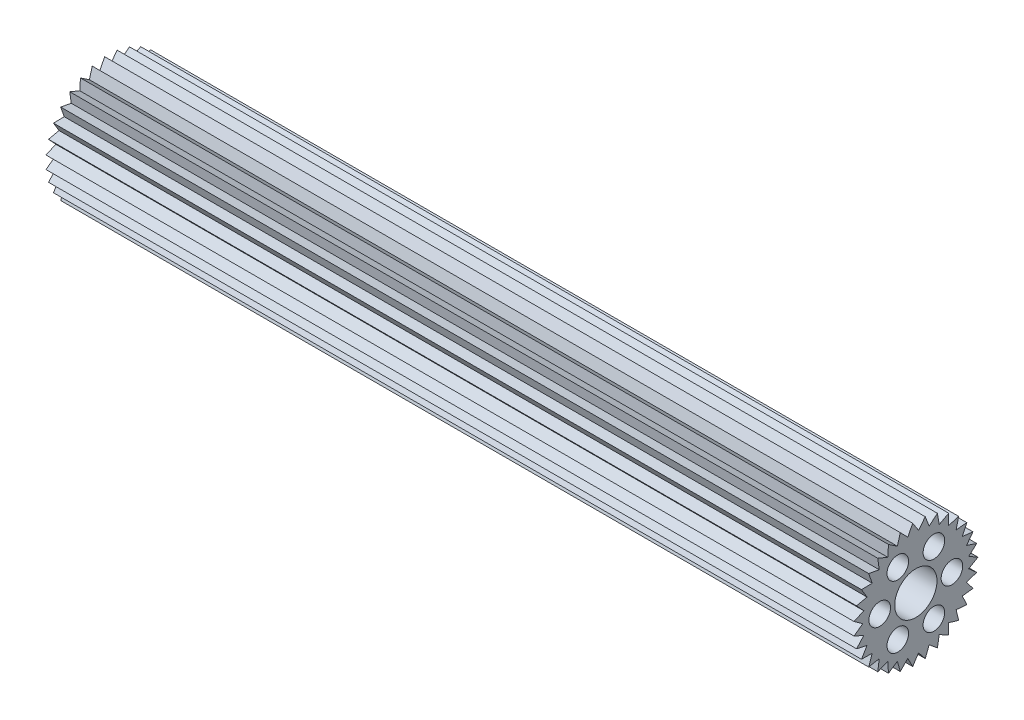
SolidWorks part; units mm, degrees
ref_plane "Front Plane" through (0, 0, 0) normal (0, 0, 1) x (1, 0, 0)
ref_plane "Top Plane" through (0, 0, 0) normal (0, 1, 0) x (1, 0, 0)
ref_plane "Right Plane" through (0, 0, 0) normal (1, 0, 0) x (0, 0, -1)
sketch "Sketch1" plane through (0, 0, 0) normal (1, 0, 0) x (0, 0, -1)
  circle A0 centre (0, 0) radius 15
extrude "Boss-Extrude1" add sketch "Sketch1" along normal blind 200
sketch "Sketch2" plane through (200, 0, 0) normal (1, 0, 0) x (0, 0, -1)
  circle A0 centre (0, 0) radius 5
extrude "Cut-Extrude1" cut sketch "Sketch2" against normal blind 250
sketch "Sketch3" plane through (0, 0, 0) normal (-1, 0, 0) x (0, 0, 1)
  circle A0 centre (0, 0) radius 15
sketch3d "3DSketch5"
  line L0 (200, 0, -15) -> (198, 0, -15)
  line L1 (198, 0, -15) -> (196.8797, 0, -14.0073)
  line L2 (196.8797, 0, -14.0073) -> (196, 0, -15)
  line L3 (196, 0, -15) -> (198, 0, -15)
  circle A0 centre (200, 0, 0) radius 15 construction
  point P4 (215, 0, 0)
  dimension "D1" = 180
  dimension "D2" = 2
  dimension "D3" = 2
sketch "Sketch5" plane through (200, 0, 0) normal (1, 0, 0) x (0, 0, -1)
  circle A0 centre (0, 0) radius 15
sketch "Sketch6" plane through (0, 0, 0) normal (-1, 0, 0) x (0, 0, 1)
  line L0 (-14.6929, 3.0195) -> (-12.7505, 1.2941)
  line L1 (-15, 0) -> (-12.75, -1.299)
  line L2 (-12.75, -1.299) -> (-12.75, 1.299)
  line L3 (-12.75, 1.299) -> (-15, 0)
  line L4 (-12.7505, 1.2941) -> (-12.2275, 3.839)
  line L5 (-12.2275, 3.839) -> (-14.6929, 3.0195)
  line L6 (-13.7844, 5.9153) -> (-12.229, 3.8343)
  line L7 (-12.229, 3.8343) -> (-11.2044, 6.2218)
  line L8 (-11.2044, 6.2218) -> (-13.7844, 5.9153)
  line L9 (-12.3115, 8.569) -> (-11.2068, 6.2175)
  line L10 (-11.2068, 6.2175) -> (-9.7226, 8.3499)
  line L11 (-9.7226, 8.3499) -> (-12.3115, 8.569)
  line L12 (-10.3345, 10.8719) -> (-9.7259, 8.3461)
  line L13 (-9.7259, 8.3461) -> (-7.8428, 10.1361)
  line L14 (-7.8428, 10.1361) -> (-10.3345, 10.8719)
  line L15 (-7.9345, 12.7297) -> (-7.8467, 10.1331)
  line L16 (-7.8467, 10.1331) -> (-5.6419, 11.5074)
  line L17 (-5.6419, 11.5074) -> (-7.9345, 12.7297)
  line L18 (-5.2096, 14.0663) -> (-5.6463, 11.5052)
  line L19 (-5.6463, 11.5052) -> (-3.21, 12.4075)
  line L20 (-3.21, 12.4075) -> (-5.2096, 14.0663)
  line L21 (-2.2714, 14.827) -> (-3.2148, 12.4063)
  line L22 (-3.2148, 12.4063) -> (-0.6466, 12.7997)
  line L23 (-0.6466, 12.7997) -> (-2.2714, 14.827)
  line L24 (0.7597, 14.9807) -> (-0.6516, 12.7994)
  line L25 (-0.6516, 12.7994) -> (1.9431, 12.6678)
  line L26 (1.9431, 12.6678) -> (0.7597, 14.9807)
  line L27 (3.7598, 14.5212) -> (1.9383, 12.6686)
  line L28 (1.9383, 12.6686) -> (4.4534, 12.0174)
  line L29 (4.4534, 12.0174) -> (3.7598, 14.5212)
  line L30 (6.6059, 13.4671) -> (4.4487, 12.0191)
  line L31 (4.4487, 12.0191) -> (6.7813, 10.8749)
  line L32 (6.7813, 10.8749) -> (6.6059, 13.4671)
  line L33 (9.1816, 11.8616) -> (6.7771, 10.8775)
  line L34 (6.7771, 10.8775) -> (8.8316, 9.2872)
  line L35 (8.8316, 9.2872) -> (9.1816, 11.8616)
  line L36 (11.3814, 9.7706) -> (8.828, 9.2907)
  line L37 (8.828, 9.2907) -> (10.5203, 7.3193)
  line L38 (10.5203, 7.3193) -> (11.3814, 9.7706)
  line L39 (13.1152, 7.2795) -> (10.5175, 7.3234)
  line L40 (10.5175, 7.3234) -> (11.7783, 5.0518)
  line L41 (11.7783, 5.0518) -> (13.1152, 7.2795)
  line L42 (14.3121, 4.4904) -> (11.7764, 5.0563)
  line L43 (11.7764, 5.0563) -> (12.5542, 2.5774)
  line L44 (12.5542, 2.5774) -> (14.3121, 4.4904)
  line L45 (14.923, 1.5175) -> (12.5532, 2.5823)
  line L46 (12.5532, 2.5823) -> (12.816, -0.0025)
  line L47 (12.816, -0.0025) -> (14.923, 1.5175)
  line L48 (14.923, -1.5175) -> (12.816, 0.0025)
  line L49 (12.816, 0.0025) -> (12.5532, -2.5823)
  line L50 (12.5532, -2.5823) -> (14.923, -1.5175)
  line L51 (14.3121, -4.4904) -> (12.5542, -2.5774)
  line L52 (12.5542, -2.5774) -> (11.7764, -5.0563)
  line L53 (11.7764, -5.0563) -> (14.3121, -4.4904)
  line L54 (13.1152, -7.2795) -> (11.7783, -5.0518)
  line L55 (11.7783, -5.0518) -> (10.5175, -7.3234)
  line L56 (10.5175, -7.3234) -> (13.1152, -7.2795)
  line L57 (11.3814, -9.7706) -> (10.5203, -7.3193)
  line L58 (10.5203, -7.3193) -> (8.828, -9.2907)
  line L59 (8.828, -9.2907) -> (11.3814, -9.7706)
  line L60 (9.1816, -11.8616) -> (8.8316, -9.2872)
  line L61 (8.8316, -9.2872) -> (6.7771, -10.8775)
  line L62 (6.7771, -10.8775) -> (9.1816, -11.8616)
  line L63 (6.6059, -13.4671) -> (6.7813, -10.8749)
  line L64 (6.7813, -10.8749) -> (4.4487, -12.0191)
  line L65 (4.4487, -12.0191) -> (6.6059, -13.4671)
  line L66 (3.7598, -14.5212) -> (4.4534, -12.0174)
  line L67 (4.4534, -12.0174) -> (1.9383, -12.6686)
  line L68 (1.9383, -12.6686) -> (3.7598, -14.5212)
  line L69 (0.7597, -14.9807) -> (1.9431, -12.6678)
  line L70 (1.9431, -12.6678) -> (-0.6516, -12.7994)
  line L71 (-0.6516, -12.7994) -> (0.7597, -14.9807)
  line L72 (-2.2714, -14.827) -> (-0.6466, -12.7997)
  line L73 (-0.6466, -12.7997) -> (-3.2148, -12.4063)
  line L74 (-3.2148, -12.4063) -> (-2.2714, -14.827)
  line L75 (-5.2096, -14.0663) -> (-3.21, -12.4075)
  line L76 (-3.21, -12.4075) -> (-5.6463, -11.5052)
  line L77 (-5.6463, -11.5052) -> (-5.2096, -14.0663)
  line L78 (-7.9345, -12.7297) -> (-5.6419, -11.5074)
  line L79 (-5.6419, -11.5074) -> (-7.8467, -10.1331)
  line L80 (-7.8467, -10.1331) -> (-7.9345, -12.7297)
  line L81 (-10.3345, -10.8719) -> (-7.8428, -10.1361)
  line L82 (-7.8428, -10.1361) -> (-9.7259, -8.3461)
  line L83 (-9.7259, -8.3461) -> (-10.3345, -10.8719)
  line L84 (-12.3115, -8.569) -> (-9.7226, -8.3499)
  line L85 (-9.7226, -8.3499) -> (-11.2068, -6.2175)
  line L86 (-11.2068, -6.2175) -> (-12.3115, -8.569)
  line L87 (-13.7844, -5.9153) -> (-11.2044, -6.2218)
  line L88 (-11.2044, -6.2218) -> (-12.229, -3.8343)
  line L89 (-12.229, -3.8343) -> (-13.7844, -5.9153)
  line L90 (-14.6929, -3.0195) -> (-12.2275, -3.839)
  line L91 (-12.2275, -3.839) -> (-12.7505, -1.2941)
  line L92 (-12.7505, -1.2941) -> (-14.6929, -3.0195)
  circle A0 centre (0, 0) radius 15
  circle A1 centre (-13.5, 0) radius 0.75 construction
  point P101 (0, 0)
  dimension "D1" = 31
extrude "Cut-Extrude2" cut sketch "Sketch6" against normal blind 234 contours L69 L68 M2 | L72 L71 M2 | L75 L74 M2 | L78 L77 M2 | L81 L80 M2 | L84 L83 M2 | L87 L86 M2 | L90 L89 M2 | L92 L1 M2 | L3 L0 M2 | L6 L5 M2 | L9 L8 M2 | L12 L11 M2 | L15 L14 M2 | L18 L17 M2 | L21 L20 M2 | L24 L23 M2 | L27 L26 M2 | L30 L29 M2 | L33 L32 M2 | L36 L35 M2 | L39 L38 M2 | L42 L41 M2 | L45 L44 M2 | L48 L47 M2 | L51 L50 M2 | L54 L53 M2 | L57 L56 M2 | L60 L59 M2 | L63 L62 M2 | L66 L65 M2
sketch "Sketch7" plane through (200, 0, 0) normal (1, 0, 0) x (0, 0, -1)
  circle A0 centre (0, 0) radius 8.7131
  circle A1 centre (-8.7131, 0) radius 2.6026
  circle A2 centre (-4.3565, 7.5458) radius 2.6026
  circle A3 centre (4.3565, 7.5458) radius 2.6026
  circle A4 centre (8.7131, 0) radius 2.6026
  circle A5 centre (4.3565, -7.5458) radius 2.6026
  circle A6 centre (-4.3565, -7.5458) radius 2.6026
  circle A7 centre (0, 0) radius 5.1
  point P18 (0, 0)
  dimension "D1" = 6
extrude "Cut-Extrude3" cut sketch "Sketch7" against normal blind 272 contours A7 | A0 A5 | A0 A5 | A0 A6 | A0 A6 | A0 A1 | A0 A1 | A0 A2 | A0 A3 | A0 A3 | A0 A4 | A0 A4 | A0 A2
sketch "Sketch8" plane through (200, 0, 0) normal (1, 0, 0) x (0, 0, -1)
  circle A0 centre (0.5466, 0) radius 48.5018
extrude "Cut-Extrude4" cut sketch "Sketch8" against normal blind 5
